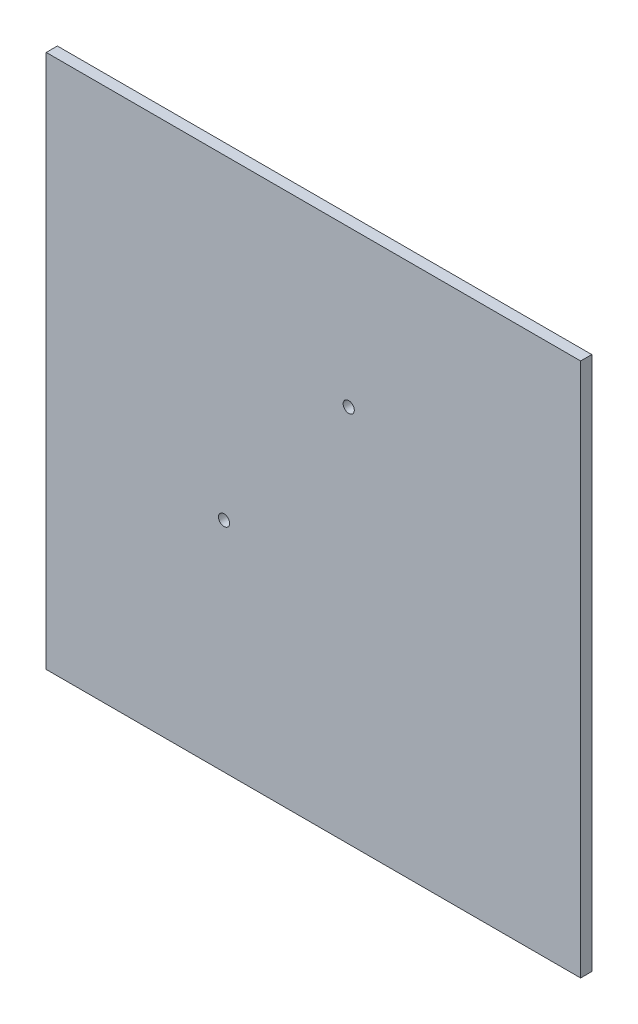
SolidWorks part; units mm, degrees
ref_plane "Front Plane" through (0, 0, 0) normal (0, 0, 1) x (1, 0, 0)
ref_plane "Top Plane" through (0, 0, 0) normal (0, 1, 0) x (1, 0, 0)
ref_plane "Right Plane" through (0, 0, 0) normal (1, 0, 0) x (0, 0, -1)
sketch "Sketch1" plane through (0, 0, 0) normal (0, 0, 1) x (1, 0, 0)
  line L0 (50.7042, 62.2334) -> (86.2642, 62.2334) construction
  line L1 (0, 0) -> (152.4, 0)
  line L2 (0, 0) -> (0, 152.4)
  line L3 (0, 152.4) -> (152.4, 152.4)
  line L4 (152.4, 0) -> (152.4, 152.4)
  line L5 (86.2642, 62.2334) -> (86.2642, 107.9534) construction
  circle A0 centre (50.7042, 62.2334) radius 1.5875
  circle A1 centre (86.2642, 107.9534) radius 1.5875
  dimension "D5" = 3.175
  dimension "D1" = 152.4
  dimension "D2" = 152.4
  dimension "D3" = 35.56
  dimension "D4" = 45.72
extrude "Boss-Extrude1" add sketch "Sketch1" along normal blind 3.175
